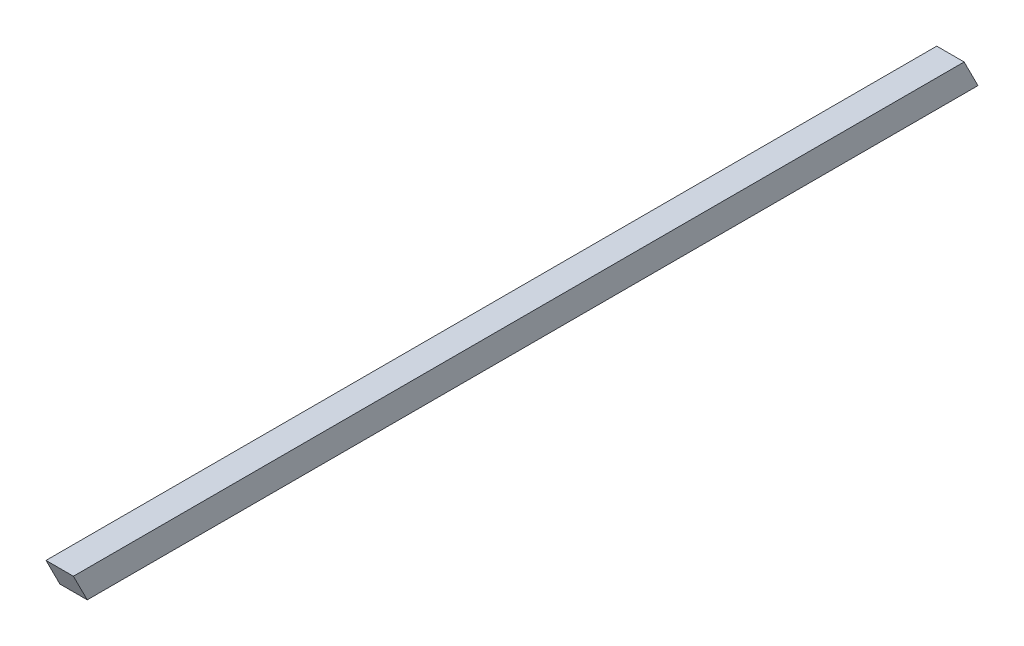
SolidWorks part; units mm, degrees
ref_plane "Plan de face" through (0, 0, 0) normal (0, 0, 1) x (1, 0, 0)
ref_plane "Plan de dessus" through (0, 0, 0) normal (0, 1, 0) x (1, 0, 0)
ref_plane "Plan de droite" through (0, 0, 0) normal (1, 0, 0) x (0, 0, -1)
sketch "Esquisse1" plane through (0, 0, 0) normal (0, 0, 1) x (1, 0, 0)
  line L1 (-2, 2) -> (2, 2)
  line L2 (-2, 2) -> (-2, -2)
  line L3 (-2, -2) -> (2, -2)
  line L4 (2, 2) -> (2, -2)
  point P4 (0, 2)
  point P5 (-2, 0)
  dimension "D1" = 4
  dimension "D2" = 4
extrude "Extrusion1" add sketch "Esquisse1" along normal mid plane 130
sketch "Esquisse2" plane through (-2, 0, 0) normal (-1, 0, 0) x (0, 0, 1)
  line L1 (65, 2) -> (-65, 2) construction
  line L2 (-65, -2) -> (-62.9777, 2)
  line L3 (-65, 2) -> (-65, -2) construction
  line L4 (-65, 2) -> (-65, -2)
  line L5 (-62.9777, 2) -> (-65, 2)
  dimension "D1" = 26.82
extrude "Enlèv. mat.-Extru.1" cut sketch "Esquisse2" against normal blind 300
sketch "Esquisse3" plane through (-2, 0, 0) normal (-1, 0, 0) x (0, 0, 1)
  line L0 (65, 2) -> (65, -2) construction
  line L1 (65, 2) -> (65, -2)
  line L2 (65, 2) -> (67.0223, 2)
  line L3 (67.0223, 2) -> (65, -2)
  line L4 (-65, -2) -> (-62.9777, 2) construction
extrude "Extrusion2" add sketch "Esquisse3" against normal blind 4
